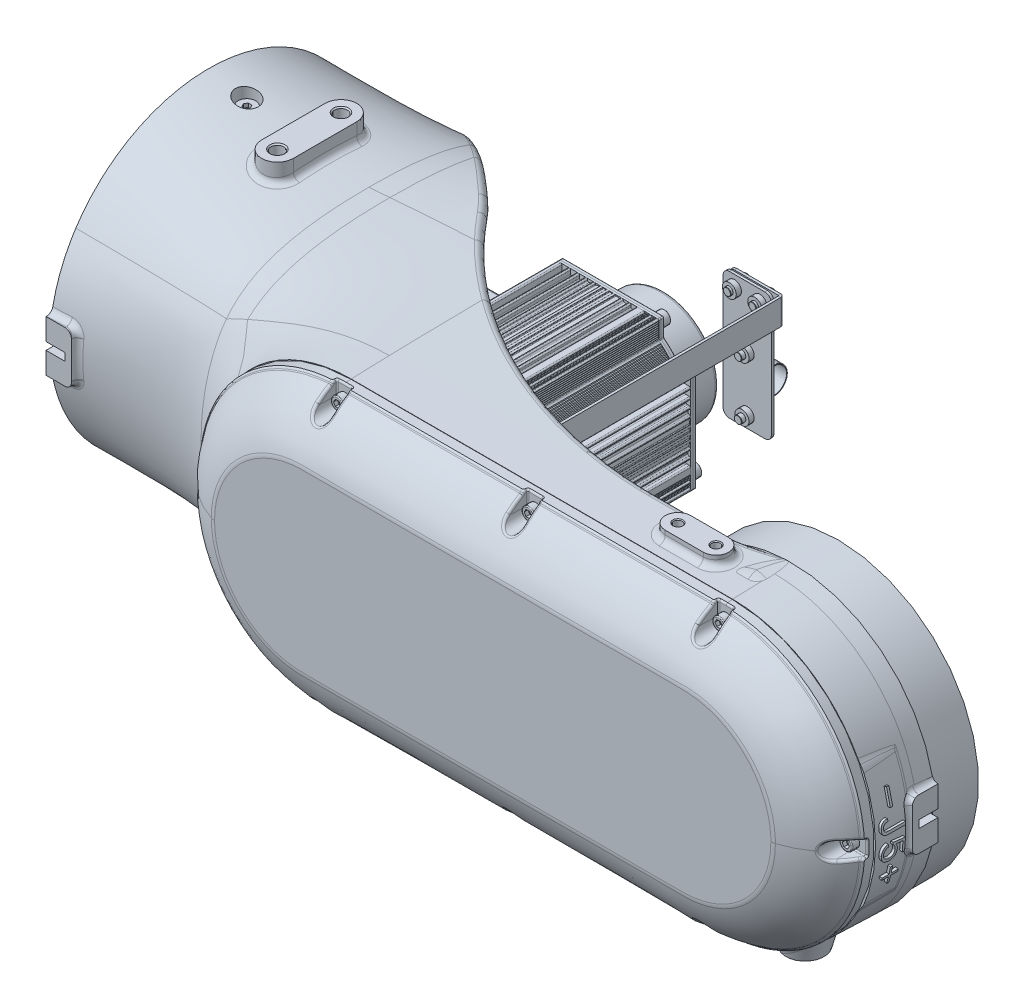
SolidWorks part; units mm, degrees
ref_plane "前视基准面" through (0, 0, 0) normal (0, 0, 1) x (1, 0, 0)
ref_plane "上视基准面" through (0, 0, 0) normal (0, 1, 0) x (1, 0, 0)
ref_plane "右视基准面" through (0, 0, 0) normal (1, 0, 0) x (0, 0, -1)
imported_body "小臂装配E-1-solid1"
sketch "草图1" plane through (0, 0, 90) normal (0, 0, -1) x (-1, 0, 0)
  line L1 (239.4507, 66.0124) -> (372.6493, 66.0124)
  line L2 (239.4507, 66.0124) -> (239.4507, -66.0124)
  line L3 (239.4507, -66.0124) -> (372.6493, -66.0124)
  line L4 (372.6493, 66.0124) -> (372.6493, -66.0124)
  line L5 (239.4507, 66.0124) -> (372.6493, -66.0124) construction
  line L6 (239.4507, -66.0124) -> (372.6493, 66.0124) construction
  point P0 (306.05, 0)
surface "曲面-基准面1" sketch "草图1"
split "分割1" trim tools "曲面-基准面1" bodies to split 122 resulting bodies 124 125
